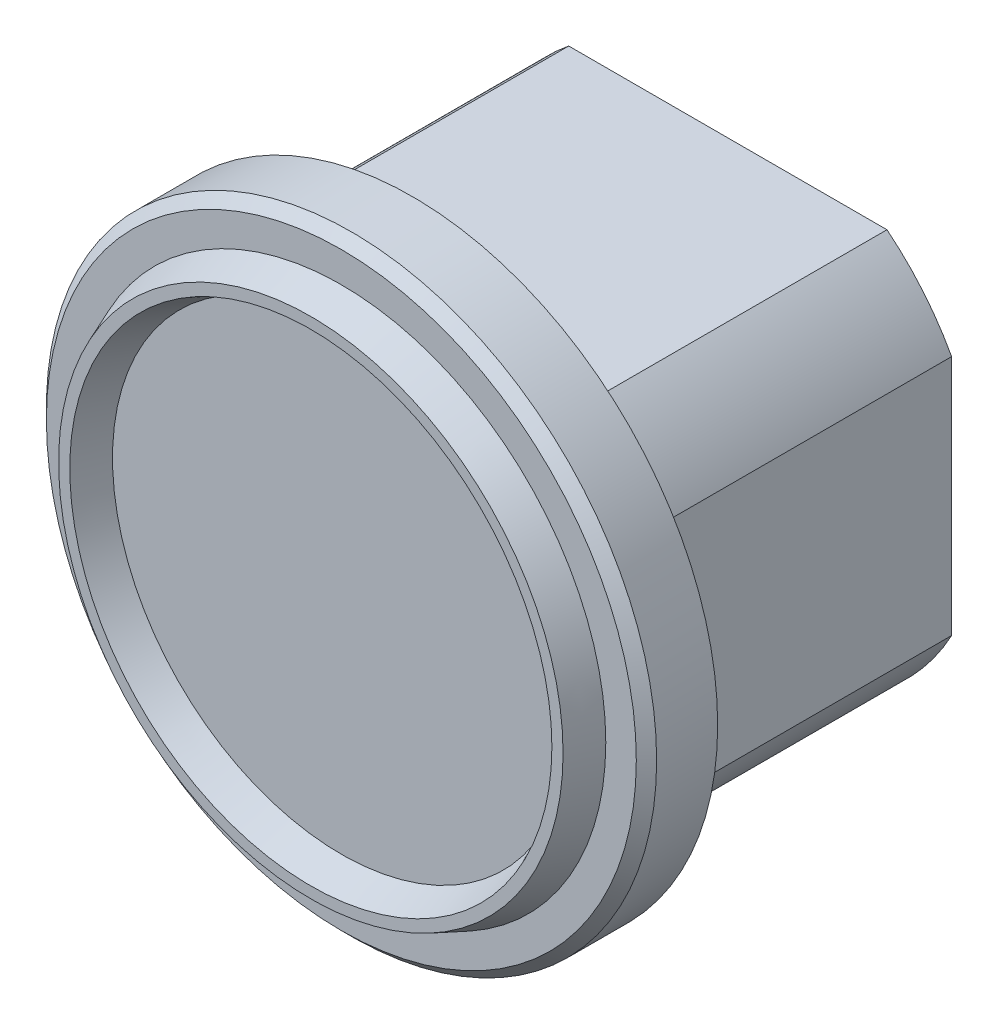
SolidWorks part; units mm, degrees
ref_plane "Ebene vorne" through (0, 0, 0) normal (0, 0, 1) x (1, 0, 0)
ref_plane "Ebene oben" through (0, 0, 0) normal (0, 1, 0) x (1, 0, 0)
ref_plane "Ebene rechts" through (0, 0, 0) normal (1, 0, 0) x (0, 0, -1)
sketch "Skizze1" plane through (0, 0, 0) normal (0, 0, 1) x (1, 0, 0)
  line L0 (22, 39) -> (22, -5.4538) construction
  line L1 (6.3555, 0) -> (37.6445, 0)
  line L2 (0, 7.6257) -> (0, 31.3743)
  line L3 (6.3555, 39) -> (37.6445, 39)
  line L4 (44, 7.6257) -> (44, 31.3743)
  line L5 (22, -5.4538) -> (0, 19.5) construction
  line L6 (0, 19.5) -> (47.6431, 19.5) construction
  arc A0 (0, 7.6257) -> (6.3555, 0) centre (22, 19.5) ccw
  arc A1 (6.3555, 39) -> (0, 31.3743) centre (22, 19.5) ccw
  arc A2 (44, 31.3743) -> (37.6445, 39) centre (22, 19.5) ccw
  arc A3 (37.6445, 0) -> (44, 7.6257) centre (22, 19.5) ccw
  dimension "D3" = 50
  dimension "D1" = 39
extrude "Aufsatz-Linear austragen1" add sketch "Skizze1" along normal blind 31
sketch "Skizze2" plane through (0, 0, 31) normal (0, 0, 1) x (1, 0, 0)
  line L0 (44, 19.5) -> (0.8442, 19.5) construction
  line L1 (44, 7.6257) -> (44, 31.3743) construction
  line L2 (22, 39) -> (22, 7.374) construction
  line L3 (37.6445, 39) -> (6.3555, 39) construction
  circle A0 centre (22, 19.5) radius 30
  dimension "D1" = 60
extrude "Aufsatz-Linear austragen2" add sketch "Skizze2" along normal blind 7
chamfer "Fase1" distance 1 angle 45 1 edges at (52, 19.5, 38)
sketch "Skizze3" plane through (0, 0, 38) normal (0, 0, 1) x (1, 0, 0)
  circle A0 centre (22, 19.5) radius 22.5
  circle A1 centre (22, 19.5) radius 26
  dimension "D1" = 45
  dimension "D2" = 52
extrude "Aufsatz-Linear austragen3" add sketch "Skizze3" along normal blind 3
chamfer "Fase3" distance 3 distance2 1.2 1 edges at (48, 19.5, 41)
chamfer "Fase4" distance 1.2 distance2 3 1 edges at (44.5, 19.5, 41)
